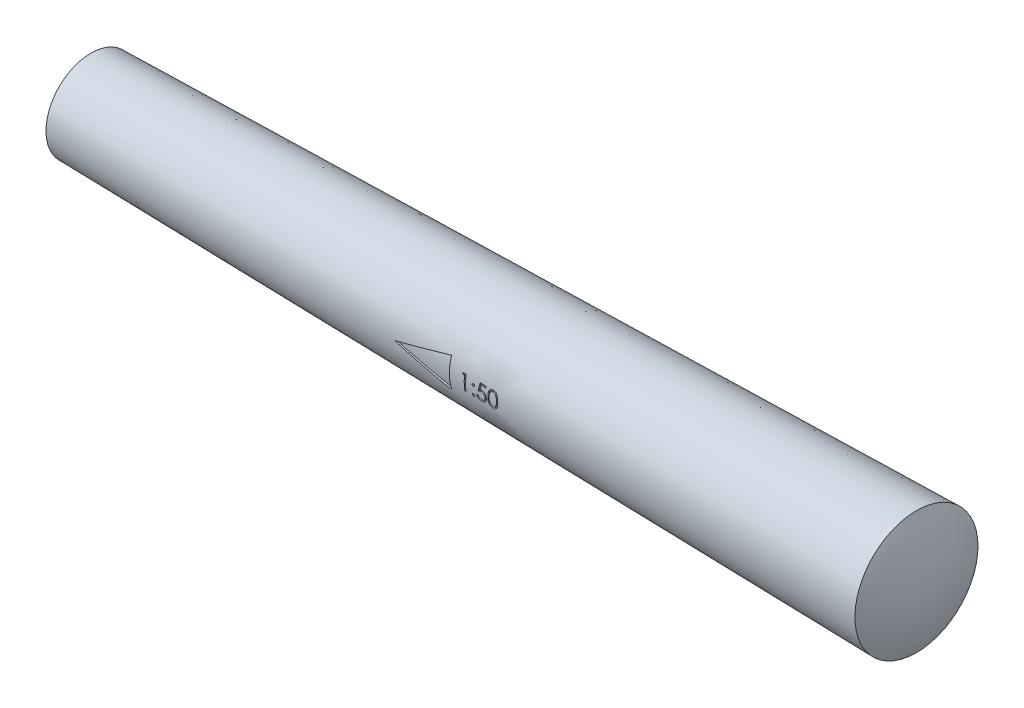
SolidWorks part; units mm, degrees
ref_plane "Front Plane" through (0, 0, 0) normal (0, 0, 1) x (1, 0, 0)
ref_plane "Top Plane" through (0, 0, 0) normal (0, 1, 0) x (1, 0, 0)
ref_plane "Right Plane" through (0, 0, 0) normal (1, 0, 0) x (0, 0, -1)
sketch "Sketch1" plane through (0, 0, 0) normal (1, 0, 0) x (0, 0, -1)
  circle A0 centre (0, 0) radius 3
  dimension "D1" = 6
extrude "Extrude1" add sketch "Sketch1" along normal mid plane 55
draft "Draft1" type of draft neutral plane draft angle 1.146 faces to draft 1 parameters "D1"=1.146
sketch "Sketch2" plane through (0, 0, 0) normal (0, 0, 1) x (1, 0, 0)
  line L0 (-27.5, 0) -> (-27.5, 3)
  line L1 (-27.5, 3) -> (-27.5, -3) construction
  line L2 (-27.5, 0) -> (-28.4, 0)
  line L3 (-28.4, 0) -> (-28.4, -3.55) construction
  line L4 (27.5, 0) -> (27.5, 4.1)
  line L5 (27.5, -4.1) -> (27.5, 4.1) construction
  line L6 (27.5, 0) -> (28.4, 0)
  line L7 (28.4, 0) -> (28.4, -3.55) construction
  line L8 (-27.5, -3) -> (27.5, -4.1) construction
  arc A0 (-28.4, 0) -> (-27.5, 3) centre (-22.95, 0) cw
  arc A1 (28.4, 0) -> (27.5, 4.1) centre (18.6109, 0) ccw
  point P14 (0, -3.55)
revolve "Revolve1" add sketch "Sketch2" angle 360 about L2
sketch "Sketch5" plane through (0, 0, 0) normal (0, 0, 1) x (1, 0, 0)
  line L0 (0, 3.55) -> (0, -3.55) construction
  line L1 (27.5, 4.1) -> (-27.5, 3) construction
  line L2 (-27.5, -3) -> (27.5, -4.1) construction
ref_plane "Plane2" through (0, 0, 0) normal (-0.02, 0, 0.9998) x (0.9998, 0, 0.02)
sketch "Sketch6" plane through (0, 0, 0) normal (-0.02, 0, 0.9998) x (0.9998, 0, 0.02)
  line L0 (0, 0) -> (0, 1)
  line L1 (0, 3.55) -> (0, -3.55) construction
  line L2 (0, 1) -> (-3.7321, 0)
  line L3 (-3.7321, 0) -> (0, -1)
  line L4 (0, -1) -> (0, 0)
  line L5 (0, -0.5) -> (4, -0.5) construction
  text T0 "1:50" font "Century Gothic" height 1
  dimension "D1" = 2
  dimension "D2" = 30
  dimension "D3" = 4
wrap "Wrap2" sketch "Sketch6" wrap type deboss source sketch "Sketch6" thickness 0.1 parameters "D1"=0.1
equation "\"D2@Sketch2\" = \"D1@Sketch2\""
